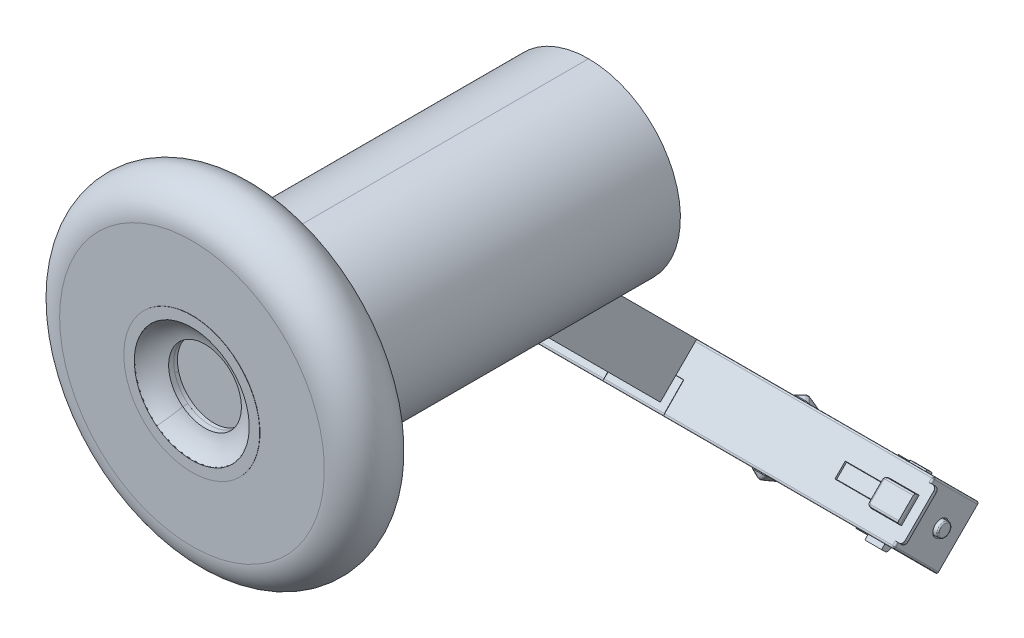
SolidWorks part; units mm, degrees
ref_plane "Alzado" through (0, 0, 0) normal (0, 0, 1) x (1, 0, 0)
ref_plane "Planta" through (0, 0, 0) normal (0, 1, 0) x (1, 0, 0)
ref_plane "Vista lateral" through (0, 0, 0) normal (1, 0, 0) x (0, 0, -1)
imported_body "48V D50 track soptlight marble.STEP-1/D50__________.STEP-1/PRO-N140C.STEP-1/882468.STEP-1/______.STEP-1-solid1"
imported_body "48V D50 track soptlight marble.STEP-1/D50__________.STEP-1/PRO-N140C.STEP-1/882468.STEP-1/______.STEP-1-solid2"
imported_body "48V D50 track soptlight marble.STEP-1/D50__________.STEP-1/PRO-N140C.STEP-1/882468.STEP-1/______.STEP-1-solid3"
imported_body "48V D50 track soptlight marble.STEP-1/D50__________.STEP-1/PRO-N140C.STEP-1/882469.STEP-1/882454.STEP-1-solid1"
imported_body "48V D50 track soptlight marble.STEP-1/D50__________.STEP-1/PRO-N140C.STEP-1/882469.STEP-1/882454.STEP-1-surface1"
imported_body "48V D50 track soptlight marble.STEP-1/D50__________.STEP-1/PRO-N140C.STEP-1/882469.STEP-1/882454.STEP-1-surface2"
imported_body "48V D50 track soptlight marble.STEP-1/D50__________.STEP-1/PRO-N140C.STEP-1/882469.STEP-1/882454.STEP-1-surface3"
imported_body "48V D50 track soptlight marble.STEP-1/D50__________.STEP-1/PRO-N140C.STEP-1/882469.STEP-1/882454.STEP-1-surface4"
imported_body "48V D50 track soptlight marble.STEP-1/D50__________.STEP-1/PRO-N140C.STEP-1/882469.STEP-1/882455.STEP-1-solid1"
imported_body "48V D50 track soptlight marble.STEP-1/D50__________.STEP-1/PRO-N140C.STEP-1/882469.STEP-1/882455.STEP-1-solid2"
imported_body "48V D50 track soptlight marble.STEP-1/D50__________.STEP-1/PRO-N140C.STEP-1/882469.STEP-1/882455.STEP-1-solid3"
imported_body "48V D50 track soptlight marble.STEP-1/D50__________.STEP-1/PRO-N140C.STEP-1/882469.STEP-1/882455.STEP-1-solid4"
imported_body "48V D50 track soptlight marble.STEP-1/D50__________.STEP-1/PRO-N140C.STEP-1/882469.STEP-1/882599.STEP-1-solid1"
imported_body "48V D50 track soptlight marble.STEP-1/D50__________.STEP-1/PRO-N140C.STEP-1/882469.STEP-1/882599.STEP-1-solid2"
imported_body "48V D50 track soptlight marble.STEP-1/D50__________.STEP-1/PRO-N140C.STEP-1/882469.STEP-1/882600.STEP-1-solid1"
imported_body "48V D50 track soptlight marble.STEP-1/D50__________.STEP-1/PRO-N140C.STEP-1/882469.STEP-1/882460.STEP-1-solid1"
imported_body "48V D50 track soptlight marble.STEP-1/D50__________.STEP-1/PRO-N140C.STEP-1/882469.STEP-1/882461.STEP-1-solid1"
imported_body "48V D50 track soptlight marble.STEP-1/D50__________.STEP-1/PRO-N140C.STEP-1/882469.STEP-1/882601.STEP-1-solid1"
imported_body "48V D50 track soptlight marble.STEP-1/D50__________.STEP-1/PRO-N140C.STEP-1/882469.STEP-1/882601.STEP-1-solid2"
imported_body "48V D50 track soptlight marble.STEP-1/D50__________.STEP-1/PRO-N140C.STEP-1/882469.STEP-1/882602.STEP-1-solid1"
imported_body "48V D50 track soptlight marble.STEP-1/D50__________.STEP-1/PRO-N140C.STEP-1/882469.STEP-1/882602.STEP-1-solid2"
imported_body "48V D50 track soptlight marble.STEP-1/D50__________.STEP-1/PRO-N140C.STEP-1/882469.STEP-1/882459_1.STEP-1-solid1"
imported_body "48V D50 track soptlight marble.STEP-1/D50__________.STEP-1/PRO-N140C.STEP-1/882469.STEP-1/882459_1.STEP-2-solid1"
imported_body "48V D50 track soptlight marble.STEP-1/D50__________.STEP-1/PRO-N140C.STEP-1/882452.STEP-1-solid1"
imported_body "48V D50 track soptlight marble.STEP-1/D50__________.STEP-1/PRO-N140C.STEP-1/882453.STEP-1-solid1"
imported_body "48V D50 track soptlight marble.STEP-1/D50__________.STEP-1/PRO-N140C.STEP-1/882462.STEP-1-solid1"
imported_body "48V D50 track soptlight marble.STEP-1/D50__________.STEP-1/PRO-N140C.STEP-1/882462.STEP-1-solid2"
imported_body "48V D50 track soptlight marble.STEP-1/D50__________.STEP-1/PRO-N140C.STEP-1/882462.STEP-1-solid3"
imported_body "48V D50 track soptlight marble.STEP-1/D50__________.STEP-1/PRO-N140C.STEP-1/808033_1.STEP-1-solid1"
imported_body "48V D50 track soptlight marble.STEP-1/D50__________.STEP-1/PRO-N140C.STEP-1/808033_1.STEP-2-solid1"
imported_body "48V D50 track soptlight marble.STEP-1/D50__________.STEP-1/881976.STEP-1/881585.STEP-1-solid1"
imported_body "48V D50 track soptlight marble.STEP-1/D50__________.STEP-1/881976.STEP-1/882612.STEP-1-solid1"
imported_body "48V D50 track soptlight marble.STEP-1/D50__________.STEP-1/881976.STEP-1/881973.STEP-1-solid1"
imported_body "48V D50 track soptlight marble.STEP-1/D50__________.STEP-1/881976.STEP-1/882611.STEP-1-solid1"
imported_body "48V D50 track soptlight marble.STEP-1/D50__________.STEP-1/881976.STEP-1/881973.STEP-2-solid1"
imported_body "48V D50 track soptlight marble.STEP-1/D50__________.STEP-1/881976.STEP-1/881974.STEP-1-solid1"
imported_body "48V D50 track soptlight marble.STEP-1/D50__________.STEP-1/881976.STEP-1/881975.STEP-1-solid1"
imported_body "48V D50 track soptlight marble.STEP-1/D50__________.STEP-1/D60_______w____.STEP-1-solid1"
imported_body "48V D50 track soptlight marble.STEP-1/D50__________.STEP-1/D50_______w.STEP-1-solid1"
imported_body "48V D50 track soptlight marble.STEP-1/D50__________.STEP-1/D50_______w.STEP-1-solid2"
imported_body "48V D50 track soptlight marble.STEP-1/D50__________.STEP-1/D50_______w.STEP-1-solid3"
imported_body "48V D50 track soptlight marble.STEP-1/D50__________.STEP-1/____.STEP-1-solid1"
imported_body "48V D50 track soptlight marble.STEP-1/D50__________.STEP-1/___z_____K.STEP-1-solid1"
imported_body "48V D50 track soptlight marble.STEP-1/D50__________.STEP-1/________.STEP-1-solid1"
imported_body "48V D50 track soptlight marble.STEP-1/D50__________.STEP-1/_______w2.STEP-1-solid1"
imported_body "48V D50 track soptlight marble.STEP-1/D50__________.STEP-1/92.70.043.00_1304________3D.STEP-1-solid1"
imported_body "48V D50 track soptlight marble.STEP-1/D50__________.STEP-1/1546-E_D22.5 38D-Refer Model.STEP-1-solid1"
imported_body "48V D50 track soptlight marble.STEP-1/D50__________.STEP-1/____-0.STEP-1-solid1"
imported_body "48V D50 track soptlight marble.STEP-1/D50__________.STEP-1/114-800349-001.STEP-1-solid1"
imported_body "48V D50 track soptlight marble.STEP-1/D50__________.STEP-1/114-801447-005.STEP-1-solid1"
imported_body "48V D50 track soptlight marble.STEP-1/D50__________.STEP-1/114-801447-005.STEP-1-solid2"
imported_body "48V D50 track soptlight marble.STEP-1/D50__________.STEP-1/___h.STEP-1-solid1"
imported_body "48V D50 track soptlight marble.STEP-1/D50__________.STEP-1/___z____.STEP-1-solid1"
imported_body "48V D50 track soptlight marble.STEP-1/D50__________.STEP-1/______-1.STEP-1-solid1"
imported_body "48V D50 track soptlight marble.STEP-1/D50__________.STEP-1/____23x19.8x1.STEP-1-solid1"
imported_body "48V D50 track soptlight marble.STEP-1/D50__________.STEP-1/800020G.STEP-1-solid1"
imported_body "48V D50 track soptlight marble.STEP-1/D50__________.STEP-1/114-803160-002.STEP-1-solid1"
imported_body "48V D50 track soptlight marble.STEP-1/D50__________.STEP-1/114-803160-002.STEP-2-solid1"
ref_plane "Plano1" through (0, 31, 0) normal (0, 1, 0) x (1, 0, 0)
sketch "Croquis1" plane through (0, 31, 0) normal (0, 1, 0) x (1, 0, 0)
  line L0 (-26.1085, -275.8117) -> (-62.1396, -275.8117)
  line L2 (-26.1085, -257.8739) -> (-26.1085, -275.8117)
  line L3 (-26.1085, -257.8739) -> (-62.1396, -257.8739)
  arc A0 (-62.1396, -257.8739) -> (-62.1396, -275.8117) centre (-62.1396, -266.8428) ccw
revolve "Revolución4" add sketch "Croquis1" angle 360 about L2
sketch "Croquis2" plane through (0, 0, 275.8739) normal (0, 0, 1) x (1, 0, 0)
  circle A0 centre (-26.1085, 30.966) radius 15.6156
extrude "Cortar-Extruir1" cut sketch "Croquis2" against normal blind 10 draft 22
